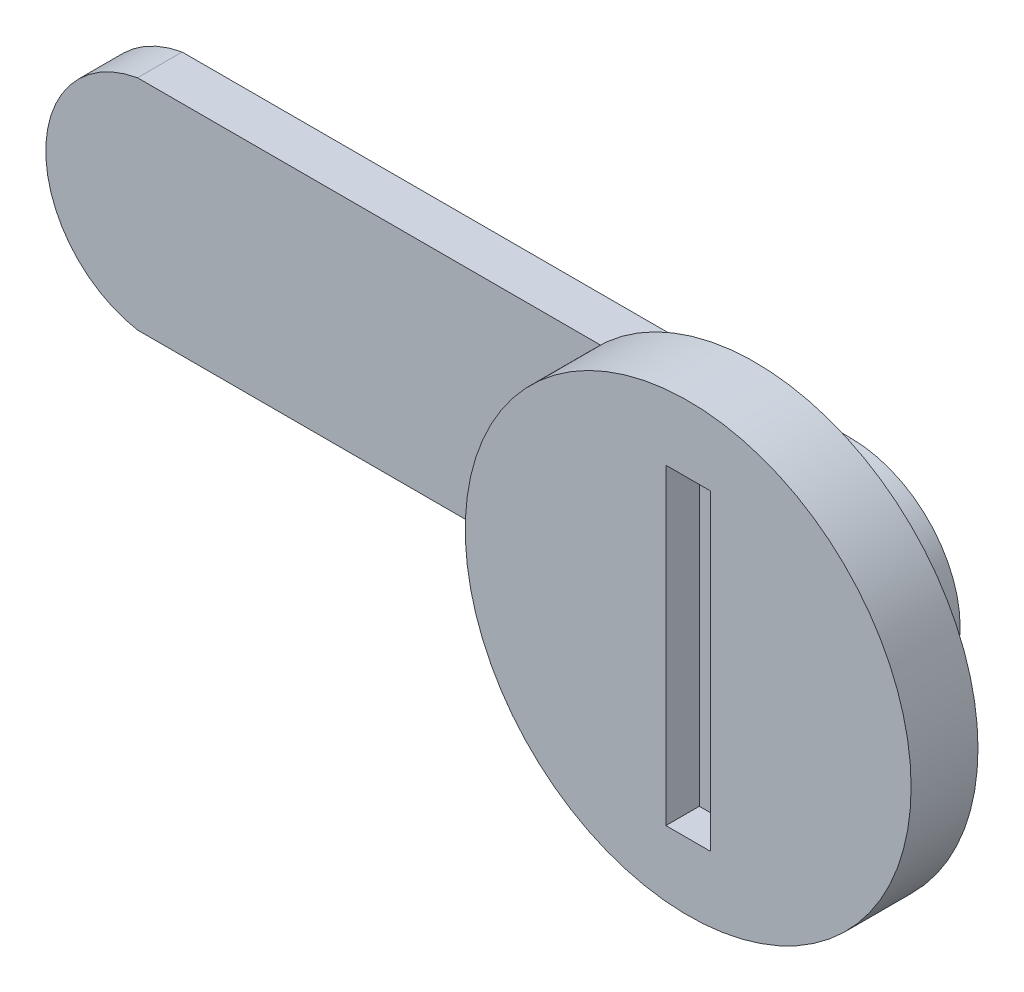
SolidWorks part; units mm, degrees
ref_plane "Front Plane" through (0, 0, 0) normal (0, 0, 1) x (1, 0, 0)
ref_plane "Top Plane" through (0, 0, 0) normal (0, 1, 0) x (1, 0, 0)
ref_plane "Right Plane" through (0, 0, 0) normal (1, 0, 0) x (0, 0, -1)
sketch "Sketch1" plane through (0, 0, 0) normal (0, 0, 1) x (1, 0, 0)
  circle A0 centre (0, 0) radius 10
  dimension "D1" = 20
extrude "Boss-Extrude1" add sketch "Sketch1" along normal blind 3
sketch "Sketch2" plane through (0, 0, 3) normal (0, 0, 1) x (1, 0, 0)
  line L0 (0, 0) -> (-1, 0) construction
  line L1 (-1, 0) -> (0, 0)
  line L2 (0, 10) -> (0, -10) construction
  line L3 (-1, 0) -> (-1, 7)
  line L4 (-1, 7) -> (1, 7)
  line L5 (-1, 0) -> (-1, -7)
  line L6 (-1, -7) -> (1, -7)
  line L7 (1, 0) -> (1, -7)
  line L8 (1, 0) -> (1, 7)
  circle A1 centre (0, 0) radius 10
  circle A2 centre (0, 0) radius 10
  point P11 (0, 7)
  point P12 (0, -7)
  dimension "D2" = 1
  dimension "D3" = 7
  dimension "D4" = 7
  dimension "D1" = 0
extrude "Cut-Extrude1" cut sketch "Sketch2" against normal blind 1.5
sketch "Sketch3" plane through (0, 0, 0) normal (0, 0, -1) x (-1, 0, 0)
  circle A0 centre (0, 0) radius 4.9
  circle A1 centre (0, 0) radius 10
  circle A2 centre (0, 0) radius 10
  dimension "D2" = 9.8
  dimension "D1" = 0
extrude "Boss-Extrude2" add sketch "Sketch3" along normal blind 2.3 contours A0
sketch "Sketch5" plane through (0, 0, -2.3) normal (0, 0, -1) x (-1, 0, 0)
  line L0 (0, 4.9) -> (0, -4.9) construction
  line L1 (0, -4.9) -> (30, -4.9)
  line L2 (0, 4.9) -> (30, 4.9)
  arc A0 (30, -4.9) -> (30, 4.9) centre (29.1391, 0) ccw
  circle A1 centre (0, 0) radius 4.9
  arc A2 (0, 4.9) -> (0, -4.9) centre (0, 0) ccw
  dimension "D2" = 30
  dimension "D3" = 30
  dimension "D1" = 0
extrude "Boss-Extrude3" add sketch "Sketch5" along normal blind 2
